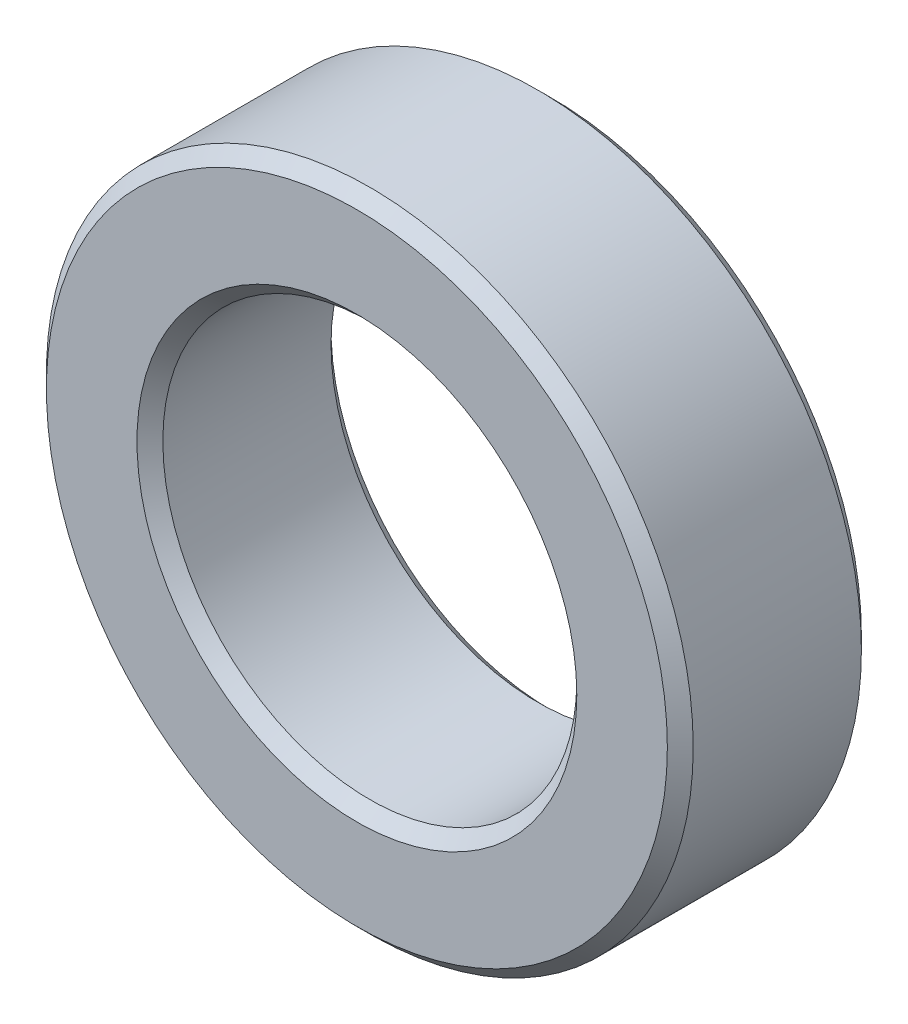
SolidWorks part; units mm, degrees
ref_plane "Front Plane" through (0, 0, 0) normal (0, 0, 1) x (1, 0, 0)
ref_plane "Top Plane" through (0, 0, 0) normal (0, 1, 0) x (1, 0, 0)
ref_plane "Right Plane" through (0, 0, 0) normal (1, 0, 0) x (0, 0, -1)
sketch "Sketch1" plane through (0, 0, 0) normal (0, 0, 1) x (1, 0, 0)
  circle A0 centre (0, 0) radius 5
  circle A1 centre (0, 0) radius 3.2
  dimension "D1" = 10
  dimension "D2" = 6.4
extrude "Boss-Extrude2" add sketch "Sketch1" along normal mid plane 3
chamfer "Chamfer3" distance 0.2 angle 45 4 edges at (5, 0, 1.5) (5, 0, -1.5) (3.2, 0, -1.5) (3.2, 0, 1.5)
